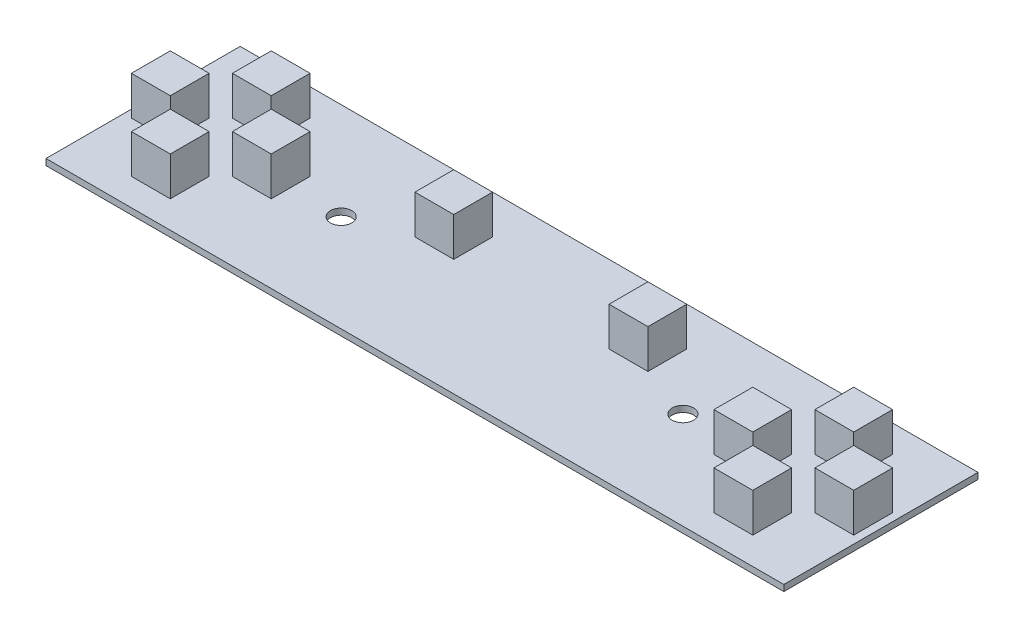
SolidWorks part; units mm, degrees
ref_plane "Front Plane" through (0, 0, 0) normal (0, 0, 1) x (1, 0, 0)
ref_plane "Top Plane" through (0, 0, 0) normal (0, 1, 0) x (1, 0, 0)
ref_plane "Right Plane" through (0, 0, 0) normal (1, 0, 0) x (0, 0, -1)
sketch "Sketch1" plane through (0, 0, 0) normal (0, 1, 0) x (1, 0, 0)
  line L1 (-95, -25) -> (95, -25)
  line L2 (-95, -25) -> (-95, 25)
  line L3 (-95, 25) -> (95, 25)
  line L4 (95, -25) -> (95, 25)
  line L5 (-95, -25) -> (95, 25) construction
  line L6 (-95, 25) -> (95, -25) construction
  point P0 (0, 0)
  dimension "D1" = 50
  dimension "D2" = 190
extrude "Base" add sketch "Sketch1" along normal mid plane 1.6 contours L3 L4 L1 L2
sketch "Sketch2" plane through (0, 0.8, 0) normal (0, 1, 0) x (1, 0, 0)
  line L0 (0, 0) -> (0, 25) construction
  line L1 (-57, 5) -> (-57, -5)
  line L2 (-67, 5) -> (-57, 5)
  line L3 (-95, 25) -> (95, 25) construction
  line L4 (-67, -5) -> (-57, -5)
  line L5 (-80, 8) -> (-70, 8)
  line L6 (-80, 8) -> (-80, 18)
  line L7 (-80, 18) -> (-70, 18)
  line L8 (-70, 8) -> (-70, 18)
  line L9 (-80, 8) -> (-70, 18) construction
  line L10 (-80, 18) -> (-70, 8) construction
  line L11 (-67, 5) -> (-67, -5)
  line L12 (-70, -18) -> (-80, -18)
  line L13 (-70, -8) -> (-70, -18)
  line L14 (-80, -8) -> (-80, -18)
  line L15 (-70, -8) -> (-80, -8)
  line L16 (-93, -5) -> (-93, 5)
  line L17 (-83, -5) -> (-93, -5)
  line L18 (-83, 5) -> (-93, 5)
  line L19 (-83, -5) -> (-83, 5)
  line L20 (20, 15) -> (30, 5) construction
  line L21 (-20, 5) -> (-30, 5)
  line L22 (-20, 5) -> (-20, 15)
  line L23 (-20, 15) -> (-30, 15)
  line L24 (-30, 5) -> (-30, 15)
  line L25 (-20, 5) -> (-30, 15) construction
  line L26 (-20, 15) -> (-30, 5) construction
  line L27 (20, 5) -> (30, 15) construction
  line L28 (80, 18) -> (70, 8) construction
  line L29 (80, 8) -> (70, 18) construction
  line L30 (30, 5) -> (30, 15)
  line L31 (20, 15) -> (30, 15)
  line L32 (20, 5) -> (20, 15)
  line L33 (20, 5) -> (30, 5)
  line L34 (83, -5) -> (83, 5)
  line L35 (83, 5) -> (93, 5)
  line L36 (83, -5) -> (93, -5)
  line L37 (93, -5) -> (93, 5)
  line L38 (70, -8) -> (80, -8)
  line L39 (80, -8) -> (80, -18)
  line L40 (70, -8) -> (70, -18)
  line L41 (70, -18) -> (80, -18)
  line L42 (67, 5) -> (67, -5)
  line L43 (70, 8) -> (70, 18)
  line L44 (80, 18) -> (70, 18)
  line L45 (80, 8) -> (80, 18)
  line L46 (80, 8) -> (70, 8)
  line L47 (67, -5) -> (57, -5)
  line L48 (67, 5) -> (57, 5)
  line L49 (57, 5) -> (57, -5)
  circle A0 centre (-75, 0) radius 13 construction
  circle A1 centre (75, 0) radius 13 construction
  point P6 (-75, 13)
  point P12 (0, 0)
  point P14 (-25, 10)
  point P27 (-75, 0)
  point P53 (75, 0)
  point P54 (25, 10)
  point P55 (75, 13)
  point P56 (-25.348, 10.784)
  point P59 (-0.4447, -1.4453)
  dimension "D1" = 26
  dimension "D2" = 75
  dimension "D3" = 10
  dimension "D4" = 10
  dimension "D6" = 10
  dimension "D7" = 10
  dimension "D8" = 25
  dimension "D5" = 4
extrude "Switches" add sketch "Sketch2" along normal blind 10
hole_wizard "M5 Clearance Hole1" positions "Sketch6" profile "Sketch7" hole size "M5" standard "ANSI Metric"
sketch "Sketch6" plane through (0, 0.8, 0) normal (0, 1, 0) x (1, 0, 0)
  line L0 (0, 0) -> (0, 25) construction
  line L1 (-95, 25) -> (95, 25) construction
  point P0 (-44, 0)
  point P2 (-44, 0)
  point P12 (44, 0)
  point P16 (-30.6844, 46.1378)
  dimension "D1" = 44
sketch "Sketch7" plane through (-44, 0.8, 0) normal (1, 0, 0) x (0, 0, 1)
  line L0 (0, 0) -> (0, 1.6)
  line L1 (0, 1.6) -> (2.75, 1.6)
  line L2 (2.75, 1.6) -> (2.75, 0)
  line L5 (2.75, 0) -> (0, 0)
  line L11 (0, -6.35) -> (0, 107.95) construction
  dimension "Thru Hole Dia." = 5.5
  dimension "Thru Hole Depth" = 1.6
